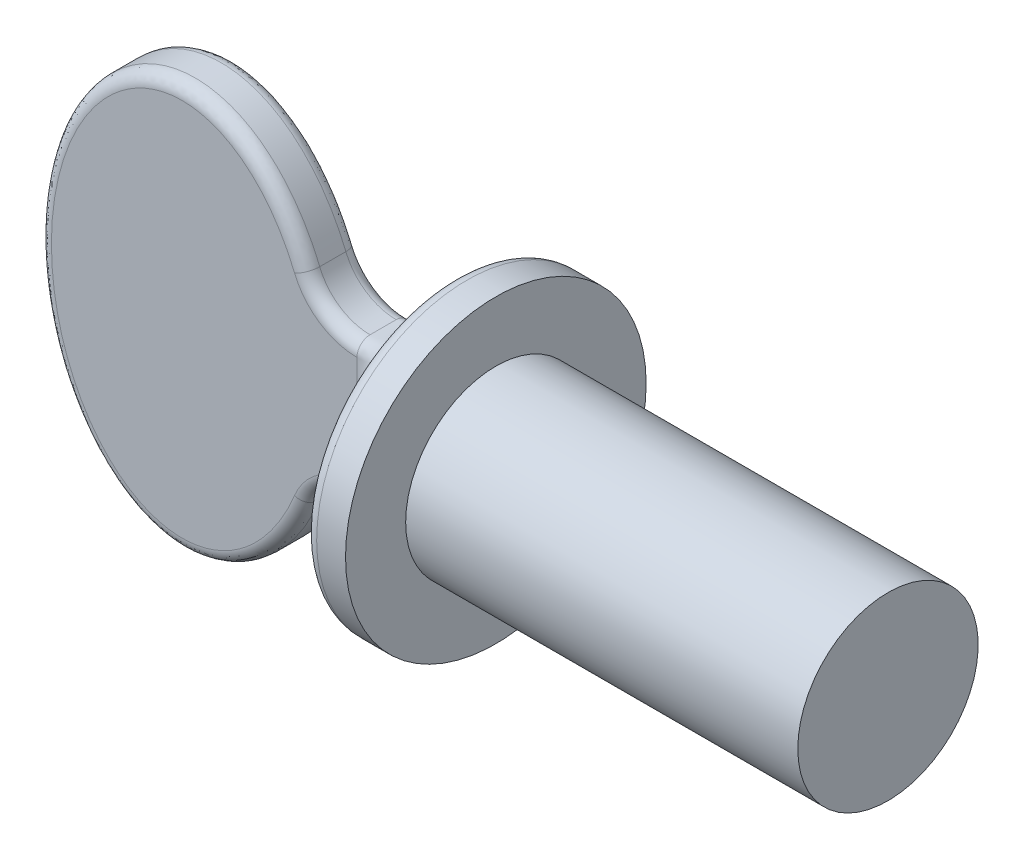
SolidWorks part; units mm, degrees
ref_plane "Front Plane" through (0, 0, 0) normal (0, 0, 1) x (1, 0, 0)
ref_plane "Top Plane" through (0, 0, 0) normal (0, 1, 0) x (1, 0, 0)
ref_plane "Right Plane" through (0, 0, 0) normal (1, 0, 0) x (0, 0, -1)
sketch "layout" plane through (0, 0, 0) normal (0, 0, 1) x (1, 0, 0)
  line L0 (0, 0) -> (13.208, 0) construction
  line L1 (5.588, 2.921) -> (5.588, -2.921)
  line L2 (3.3976, 1.3123) -> (4.8921, 1.3123) construction
  line L3 (5.588, 2.921) -> (4.7897, 2.921)
  line L4 (4.7897, 2.921) -> (4.7897, 3.2655) construction
  line L5 (4.2865, 1.706) -> (4.2865, 0)
  line L6 (4.2865, 1.706) -> (3.3355, 0.7551) construction
  line L7 (13.208, 1.7526) -> (13.208, 0)
  line L8 (3.3976, 1.3123) -> (3.3976, -1.3123)
  line L9 (13.208, 1.7526) -> (5.588, 1.7526)
  arc A0 (3.3976, 1.3123) -> (2.4197, 1.9685) centre (3.3976, 2.3692) cw
  arc A1 (4.7897, 2.921) -> (4.2865, 1.706) centre (3.0715, 2.921) cw
  arc A2 (3.3976, -1.3123) -> (2.4197, -1.9685) centre (3.3976, -2.3692) ccw
  ellipse E0 centre (0, 0) end of major axis (0, 3.937) minor radius 2.794 (2.4197, 1.9685) -> (2.4197, -1.9685) ccw
  dimension "Head Width" = 7.874
  dimension "Shoulder Dia" = 5.842
  dimension "Head Height" = 8.382
  dimension "D4" = 5.588
  dimension "D5" = 2.6247
  dimension "D6" = 3.937
  dimension "D7" = 3.4121
  dimension "D8" = 0.7983
  dimension "D9" = 45
  dimension "Length" = 7.62
  dimension "Base Screw Dia" = 3.5052
sketch "Sketch3" plane through (0, 0, 0) normal (0, 0, 1) x (1, 0, 0)
  line L0 (3.3976, 1.3123) -> (3.3976, -1.3123) construction
  line L1 (3.3976, 1.3123) -> (3.3976, -1.3123)
  arc A0 (3.3976, -1.3123) -> (2.4197, -1.9685) centre (3.3976, -2.3692) ccw construction
  arc A1 (2.4197, 1.9685) -> (3.3976, 1.3123) centre (3.3976, 2.3692) ccw construction
  arc A2 (3.3976, -1.3123) -> (2.4197, -1.9685) centre (3.3976, -2.3692) ccw
  arc A3 (2.4197, 1.9685) -> (3.3976, 1.3123) centre (3.3976, 2.3692) ccw
  ellipse E0 centre (0, 0) end of major axis (0, 3.937) minor radius 2.794 (2.4197, 1.9685) -> (2.4197, -1.9685) ccw construction
  ellipse E1 centre (0, 0) end of major axis (0, 3.937) minor radius 2.794 (2.4197, 1.9685) -> (2.4197, -1.9685) ccw
extrude "Extrude1" add sketch "Sketch3" along normal mid plane 1.016
fillet "Fillet1" radius 0.254 6 edges at (2.8088, 1.4916, -0.508) (2.8088, -1.4916, -0.508) (2.8088, 1.4916, 0.508) (2.8088, -1.4916, 0.508) (-2.794, 0, -0.508) (-2.794, 0, 0.508)
sketch "Sketch4" plane through (0, 0, 0) normal (0, 0, 1) x (1, 0, 0)
  line L1 (13.208, 1.7526) -> (5.588, 1.7526) construction
  line L2 (5.588, 2.921) -> (5.588, -2.921) construction
  line L3 (5.588, 2.921) -> (4.7897, 2.921) construction
  line L4 (4.2865, 1.706) -> (4.2865, 0) construction
  line L5 (13.208, 1.7526) -> (13.208, 0) construction
  line L6 (13.208, 1.7526) -> (5.588, 1.7526)
  line L7 (5.588, 2.921) -> (5.588, 1.7526)
  line L8 (5.588, 2.921) -> (4.7897, 2.921)
  line L9 (4.2865, 1.706) -> (4.2865, 0)
  line L10 (0, 0) -> (16.8942, 0) construction
  line L11 (13.208, 0) -> (4.2865, 0)
  line L12 (13.208, 1.7526) -> (13.208, 0)
  arc A0 (4.2865, 1.706) -> (4.7897, 2.921) centre (3.0715, 2.921) ccw construction
  arc A1 (4.2865, 1.706) -> (4.7897, 2.921) centre (3.0715, 2.921) ccw
revolve "Revolve1" add sketch "Sketch4" angle 360 about L10
loft "Loft1" add
fillet "Fillet2" radius 0.254 1 edges at (4.7897, 0, 2.921)
sketch "Sketch5" plane through (0, 0, 0) normal (0, 1, 0) x (1, 0, 0)
  line L0 (12.6625, 2.2981) -> (13.208, 2.2981)
  line L1 (13.208, 2.2981) -> (13.208, 1.7526)
  line L2 (13.208, 1.7526) -> (12.9352, 1.2802)
  line L3 (12.9352, 1.2802) -> (12.6625, 1.7526)
  line L4 (13.208, -1.7526) -> (13.208, 1.7526) construction
  line L5 (12.6625, 1.7526) -> (12.6625, 2.2981)
  line L6 (13.208, 1.7526) -> (5.588, 1.7526) construction
  line L7 (-3.6147, 0) -> (14.1406, 0) construction
  dimension "D1" = 0.4724
revolve "Cut-Revolve10" [suppressed] cut sketch "Sketch5" angle 360 about L7
pattern_linear "LPattern10" [suppressed] count 9 along (1, 0, 0)
equation "\"D4@layout\" = \"Head Height@layout\" / 3 * 2"
equation "\"D5@layout\" = \"Head Width@layout\" / 3"
equation "\"D6@layout\" = \"Head Width@layout\" / 2"
equation "\"D7@layout\" = \"D5@layout\" * 1.3"
equation "\"D8@layout\" = \"D4@layout\"  / 7"
equation "\"D1@Fillet1\" = \"Head Thickness@Extrude1\" / 4"
equation "\"D1@Fillet2\" = \"D1@Fillet1\""
equation "\"D1@Sketch5\" = ( \"Base Screw Dia@layout\"- \"Minor Dia@Cosmetic Thread1\" )  / 2"
equation "\"D1@LPattern10\" = int((\"Length@layout\")/\"Advance@LPattern10\")"
